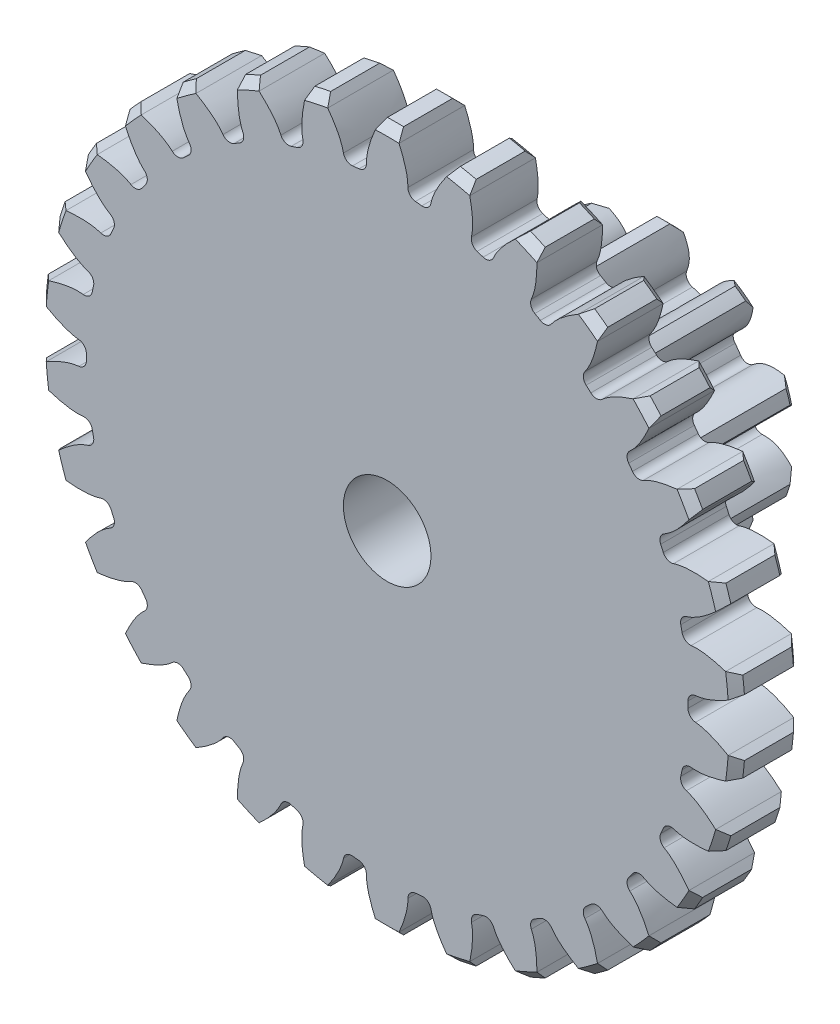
SolidWorks part; units mm, degrees
ref_plane "Plan1" through (0, 0, 0) normal (0, 0, 1) x (1, 0, 0)
ref_plane "Plan2" through (0, 0, 0) normal (0, 1, 0) x (1, 0, 0)
ref_plane "Plan3" through (0, 0, 0) normal (1, 0, 0) x (0, 0, -1)
sketch "Dent" plane through (0, 0, 0) normal (0, 0, 1) x (1, 0, 0)
  line L1 (-0.1488, 1.6323) -> (0, 1.2234)
  line L3 (0, 3) -> (0, -3) construction
  line L4 (0, 0) -> (0.1488, 2.9963) construction
  line L5 (0.3927, 2.469) -> (-0.3927, 2.469) construction
  line L6 (0.4036, 2.3143) -> (-0.4036, 2.3143) construction
  line L7 (-0.25, 0) -> (0.25, 0) construction
  line L9 (0.1488, 1.6323) -> (0, 1.2234)
  line L11 (0, 0) -> (0.3927, 2.469) construction
  line L12 (0, 0) -> (0.4036, 2.3143) construction
  circle A0 centre (0, 0) radius 2.5 construction
  circle A1 centre (0, 0) radius 3 construction
  arc A2 (0.1488, 2.9963) -> (-0.1488, 2.9963) centre (0, 0) ccw
  circle A3 centre (0, 0) radius 2.3492 construction
  point P2 (-0.3927, 2.469)
  point P3 (-0.4036, 2.3143)
  point P19 (0.3927, 2.469)
  point P20 (0.4036, 2.3143)
sketch "Esquisse2" plane through (0, 0, 0) normal (0, 0, 1) x (1, 0, 0)
  circle A0 centre (0, 0) radius 1.875
extrude "Base-Extrusion" add sketch "Esquisse2" against normal blind 5
extrude "Boss.-Extru.1" add sketch "Dent" against normal blind 5
fillet "Congé1" radius 0.19 4 edges at (0.2498, 1.8583, -2.5) (-0.2591, 1.857, -2.5)
chamfer "Chanfrein1" distance 0.19 angle 45 2 edges at (0, 3, -5)
pattern_circular "Répétition circulaire1" count 10 over 360 of "Congé1", "Boss.-Extru.1", "Chanfrein1"
sketch "Esquisse5" plane through (0, 0, 0) normal (0, 0, 1) x (1, 0, 0)
  line L0 (-3.3741, 5.9901) -> (-2.1938, 6.5156)
  arc A0 (-3.3741, 5.9901) -> (-3.2941, 6.2336) centre (-3.4674, 6.1556) ccw construction
  arc A1 (-2.4284, 6.6194) -> (-2.1938, 6.5156) centre (-2.2544, 6.6957) ccw construction
  arc A2 (-3.0845, 7.3815) -> (-3.4216, 7.2314) centre (0, 0) ccw construction
  arc A3 (-3.3741, 5.9901) -> (-3.2941, 6.2336) centre (-3.4674, 6.1556) ccw
  arc A4 (-2.4284, 6.6194) -> (-2.1938, 6.5156) centre (-2.2544, 6.6957) ccw
  arc A5 (-3.0845, 7.3815) -> (-3.4216, 7.2314) centre (0, 0) ccw
  spline S0 degree 3 poles (-3.4223, 7.0203) (-3.4213, 6.9079) (-3.4117, 6.6413) (-3.3566, 6.3725) (-3.2941, 6.2336) knots 0.104577 0.104577 0.104577 0.104577 0.271482 0.500037 0.500037 0.500037 0.500037 construction
  spline S1 degree 3 poles (-2.4284, 6.6194) (-2.4895, 6.7587) (-2.6527, 6.9793) (-2.8443, 7.1648) (-2.9272, 7.2407) knots 0.50013 0.50013 0.50013 0.50013 0.728518 0.895412 0.895412 0.895412 0.895412 construction
  spline S2 degree 3 poles (-3.0845, 7.3815) (-3.0318, 7.3349) (-2.9791, 7.2883) (-2.9272, 7.2407) knots 0 0 0 0 0.104588 0.104588 0.104588 0.104588 construction
  spline S3 degree 3 poles (-3.4223, 7.0203) (-3.4229, 7.0907) (-3.4222, 7.161) (-3.4216, 7.2314) knots 0.895423 0.895423 0.895423 0.895423 1 1 1 1 construction
  spline S4 degree 3 poles (-3.4223, 7.0203) (-3.4213, 6.9079) (-3.4117, 6.6413) (-3.3566, 6.3725) (-3.2941, 6.2336) knots 0.104577 0.104577 0.104577 0.104577 0.271482 0.500037 0.500037 0.500037 0.500037
  spline S5 degree 3 poles (-2.4284, 6.6194) (-2.4895, 6.7587) (-2.6527, 6.9793) (-2.8443, 7.1648) (-2.9272, 7.2407) knots 0.50013 0.50013 0.50013 0.50013 0.728518 0.895412 0.895412 0.895412 0.895412
  spline S6 degree 3 poles (-3.0845, 7.3815) (-3.0318, 7.3349) (-2.9791, 7.2883) (-2.9272, 7.2407) knots 0 0 0 0 0.104588 0.104588 0.104588 0.104588
  spline S7 degree 3 poles (-3.4223, 7.0203) (-3.4229, 7.0907) (-3.4222, 7.161) (-3.4216, 7.2314) knots 0.895423 0.895423 0.895423 0.895423 1 1 1 1
sketch "Esquisse6" plane through (0, 0, 0) normal (0, 0, 1) x (1, 0, 0)
  circle A0 centre (0, 0) radius 6.875
extrude "Extrusion1" add sketch "Esquisse6" along normal blind 1.5
extrude "Extrusion2" add sketch "Esquisse5" along normal blind 1.5
chamfer "Chanfrein2" distance 0.19 angle 45 2 edges at (-3.2539, 7.3084, 0) (-3.2539, 7.3084, 1.5)
pattern_circular "Répétition circulaire2" count 30 over 360 about axis through (0, 0, -5) along (0, 0, 1) of "Extrusion2", "Chanfrein2"
sketch "Esquisse7" plane through (0, 0, -5) normal (0, 0, -1) x (-1, 0, 0)
  circle A0 centre (0, 0) radius 1
  dimension "D1" = 2
extrude "Enlèv. mat.-Extru.1" cut sketch "Esquisse7" against normal through all
equation "\"Dp@Dent\" = \"Module@Dent\"*\"Nbr de dents@Répétition circulaire1\" "
equation "\"Dt@Dent\" = \"Module@Dent\"*(\"Nbr de dents@Répétition circulaire1\"+2)"
equation "\"Dpied@Esquisse2\" = \"Dp@Dent\"-(2.5*\"Module@Dent\")"
equation "\"Db@Dent\" = \"Dp@Dent\"*cos(\"Angle de pression@Dent\"*pi/180)"
equation "\"Ep au primitif@Dent\" =  (pi*\"Dp@Dent\"/2)/\"Nbr de dents@Répétition circulaire1\""
equation "\"D3@Dent\"=atn((Sin((sqr(((\"Dt@Dent\"/\"Db@Dent\")^2)-1))) -((sqr(((\"Dt@Dent\"/\"Db@Dent\")^2)-1)) * Cos((sqr(((\"Dt@Dent\"/\"Db@Dent\")^2)-1)))))/(Cos((sqr(((\"Dt@Dent\"/\"Db@Dent\")^2)-1))) +((sqr(((\"Dt@Dent\"/\"Db@"
equation "\"D4@Dent\"=atn((Sin((sqr(((\"Dp@Dent\"/\"Db@Dent\")^2)-1))) -((sqr(((\"Dp@Dent\"/\"Db@Dent\")^2)-1)) * Cos((sqr(((\"Dp@Dent\"/\"Db@Dent\")^2)-1)))))/(Cos((sqr(((\"Dp@Dent\"/\"Db@Dent\")^2)-1))) +((sqr(((\"Dp@Dent\"/\"Db@"
equation "\"D1@Congé1\" = \"Module@Dent\"*0.38"
equation "\"D1@Chanfrein1\" = \"Module@Dent\"*0.38"
equation "\"D1@Base-Extrusion\" = \"Epaisseur@Boss.-Extru.1\""
